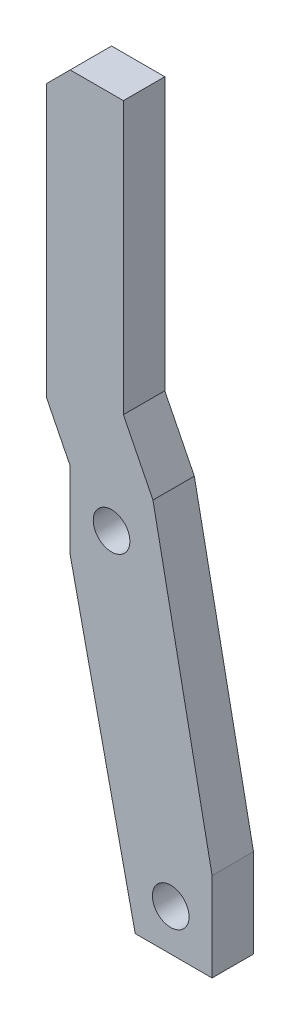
SolidWorks part; units mm, degrees
ref_plane "前视基准面" through (0, 0, 0) normal (0, 0, 1) x (1, 0, 0)
ref_plane "上视基准面" through (0, 0, 0) normal (0, 1, 0) x (1, 0, 0)
ref_plane "右视基准面" through (0, 0, 0) normal (1, 0, 0) x (0, 0, -1)
other "Configuration Table"
sketch "草图1" plane through (0, 0, 0) normal (0, 0, 1) x (1, 0, 0)
  line L0 (7, -7) -> (-6, -7)
  line L1 (-6, -7) -> (-17, 43)
  line L2 (-17, 43) -> (-17, 56)
  line L3 (-17, 56) -> (-21, 64)
  line L4 (-21, 64) -> (-21, 110)
  line L5 (-21, 110) -> (-17, 114)
  line L6 (-17, 114) -> (-8, 114)
  line L7 (-8, 114) -> (-8, 68)
  line L8 (-8, 68) -> (-3, 58)
  line L9 (-3, 58) -> (7, 8)
  line L10 (7, 8) -> (7, -7)
  dimension "D1" = 7
  dimension "D2" = 3
  dimension "D3" = 6
  dimension "D4" = 8
  dimension "D5" = 17
  dimension "D6" = 21
  dimension "D7" = 8
  dimension "D8" = 43
  dimension "D9" = 68
  dimension "D10" = 58
  dimension "D11" = 110
  dimension "D12" = 7
extrude "Parallel_Finger" add sketch "草图1" against normal mid plane 7
sketch "草图2" plane through (0, 0, 0) normal (0, 0, 1) x (1, 0, 0)
  circle A0 centre (0, 0) radius 3.1
  circle A1 centre (-10, 50) radius 3.1
  dimension "D1" = 6.2
  dimension "D2" = 10
  dimension "D3" = 50
extrude "Finger_Pivots_10x50" cut sketch "草图2" against normal mid plane 500
